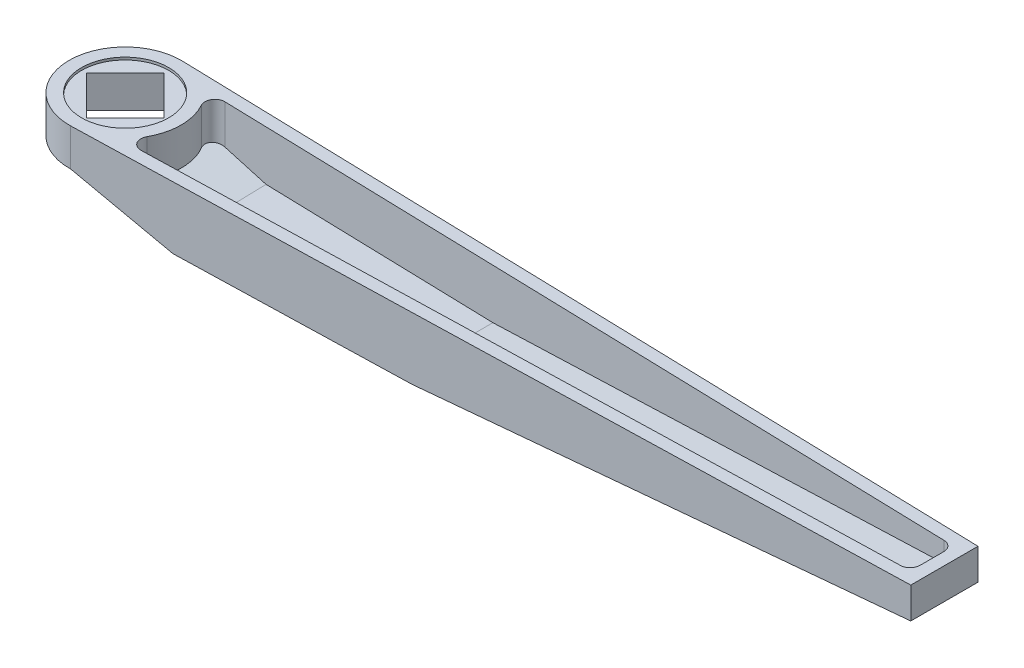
SolidWorks part; units mm, degrees
ref_plane "XY" through (0, 0, 0) normal (0, 0, 1) x (1, 0, 0)
ref_plane "XZ" through (0, 0, 0) normal (0, 1, 0) x (1, 0, 0)
ref_plane "YZ" through (0, 0, 0) normal (1, 0, 0) x (0, 0, -1)
sketch "A" plane through (0, 0, 0) normal (0, 1, 0) x (1, 0, 0)
  line L0 (0, 0) -> (329, 0) construction
  line L1 (0.6158, 22.4916) -> (329, 13.5)
  line L2 (329, 13.5) -> (329, -13.5)
  line L3 (0.6158, -22.4916) -> (329, -13.5)
  line L4 (0.6158, 22.4916) -> (0.6158, -22.4916)
  circle A0 centre (0, 0) radius 22.5
  dimension "D1" = 45
  dimension "D2" = 27
  dimension "D3" = 329
extrude "X1" add sketch "A" along normal blind 25 contours L0 A0 L3 L2 | A0 L0 L2 L1
sketch "Sketch1" plane through (0.6158, 0, 22.4916) normal (0.0274, 0, 0.9996) x (0.9996, 0, -0.0274)
  line L0 (0, 10) -> (40, 0)
  line L2 (0, 0) -> (328.5072, 0) construction
  dimension "D1" = 10
  dimension "D2" = 40
extrude "Cut-Extrude1" cut sketch "Sketch1" against normal through all and the other way through all flip side to cut
sketch "B" plane through (0, 0, 0) normal (0, 0, 1) x (1, 0, 0)
  line L0 (329, 12.5) -> (134, 0)
  line L1 (329, 25) -> (329, 0) construction
  line L2 (40.6009, 0) -> (329, 0) construction
  line L3 (134, 0) -> (134, -74.1467)
  line L4 (134, -74.1467) -> (362.4662, -74.1467)
  line L5 (362.4662, -74.1467) -> (356.9119, 12.5)
  line L6 (356.9119, 12.5) -> (329, 12.5)
  dimension "D1" = 195
extrude "X2" cut sketch "B" against normal through all and the other way through all
shell "S1" thickness 5
sketch "C" plane through (0, 25, 0) normal (0, 1, 0) x (1, 0, 0)
  circle A0 centre (0, 0) radius 22.5 construction
  circle A1 centre (0, 0) radius 22.5
extrude "X3" add sketch "C" against normal blind 15
sketch "D" plane through (0, 10, 0) normal (0, -1, 0) x (-1, 0, 0)
  circle A0 centre (0, 0) radius 17.5
  dimension "D1" = 35
extrude "X5" cut sketch "D" against normal blind 1
sketch "E" plane through (0, 25, 0) normal (0, -1, 0) x (1, 0, 0)
  circle A1 centre (0, 0) radius 17.5
  dimension "D1" = 35
extrude "X6" cut sketch "E" along normal blind 1
sketch "F" plane through (0, 24, 0) normal (0, -1, 0) x (-1, 0, 0)
  line L1 (0, 15.5563) -> (-15.5563, 0)
  line L2 (0, 15.5563) -> (15.5563, 0)
  line L3 (15.5563, 0) -> (0, -15.5563)
  line L4 (-15.5563, 0) -> (0, -15.5563)
  line L5 (0, 15.5563) -> (0, -15.5563) construction
  line L6 (15.5563, 0) -> (-15.5563, 0) construction
  point P0 (0, 0)
  dimension "D1" = 22
  dimension "D2" = 22
extrude "X7" cut sketch "F" along normal through all
fillet "F1" radius 4 4 edges at (324, 21.0949, 8.635) (324, 21.0949, -8.635) (14.6158, 18.1921, -17.1064) (14.6158, 18.3092, 17.1064)
sketch "Sketch2" plane through (0, 11, 0) normal (0, -1, 0) x (1, 0, 0)
  circle A1 centre (0, 0) radius 17.5
  circle A2 centre (0, 0) radius 17.5
  dimension "D1" = 0
extrude "Cut-Extrude2" cut sketch "Sketch2" along normal through all
